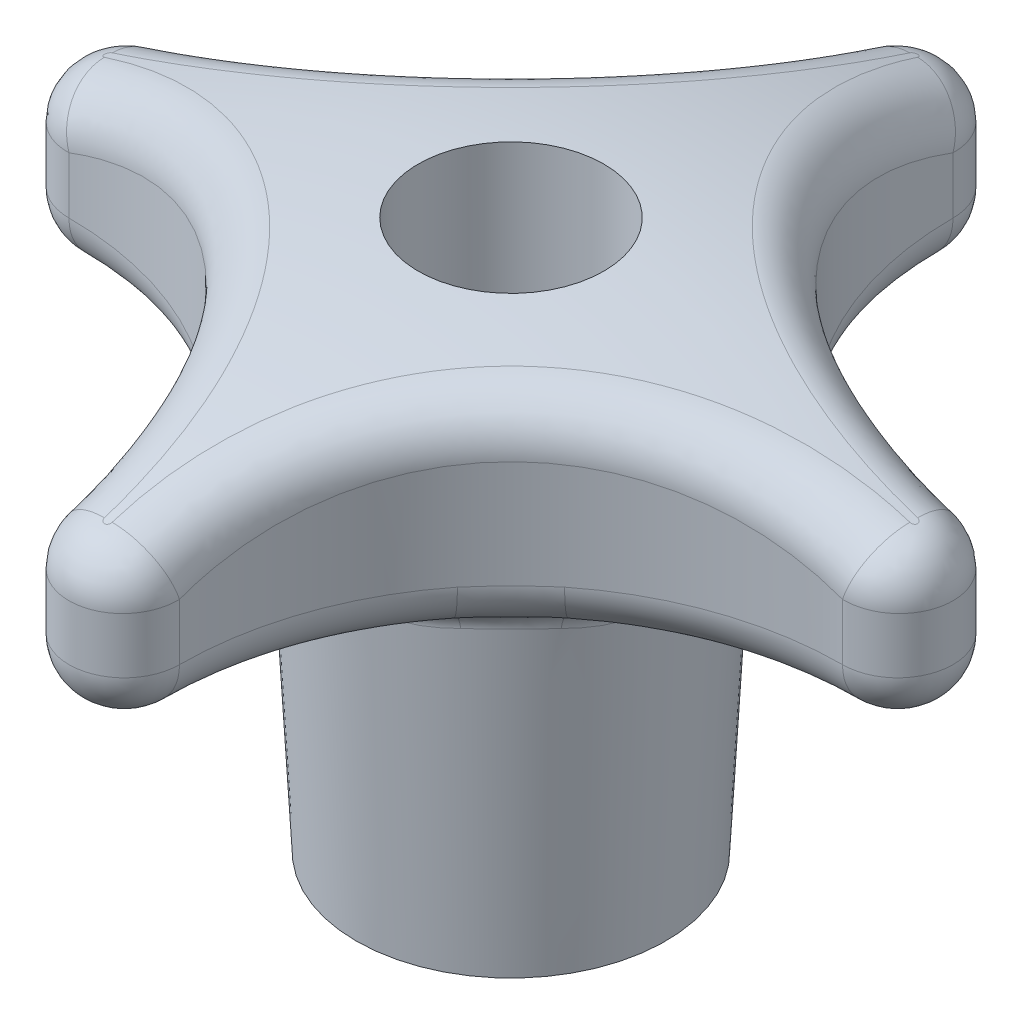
SolidWorks part; units mm, degrees
ref_plane "Front Plane" through (0, 0, 0) normal (0, 0, 1) x (1, 0, 0)
ref_plane "Top Plane" through (0, 0, 0) normal (0, 1, 0) x (1, 0, 0)
ref_plane "Right Plane" through (0, 0, 0) normal (1, 0, 0) x (0, 0, -1)
sketch "Sketch1" plane through (0, 0, 0) normal (0, 1, 0) x (1, 0, 0)
  circle A0 centre (0, 0) radius 7
  dimension "D1" = 14
extrude "Extrude1" add sketch "Sketch1" against normal blind 15
draft "Draft1" type of draft neutral plane draft angle 3 faces to draft 1 parameters "D1"=3
sketch "Sketch2" plane through (0, 0, 0) normal (0, 0, 1) x (1, 0, 0)
  line L0 (0, 0) -> (-20, 0)
  line L1 (-20, 0) -> (-20, 6.5)
  line L2 (0, 0) -> (0, 50000) construction
  line L3 (0, 10) -> (20.2547, 10) construction
  line L4 (0, 0) -> (0, 10)
  arc A0 (0, 10) -> (-20, 6.5) centre (0, -48.8929) ccw
revolve "Revolve1" add sketch "Sketch2" angle 360 about L2
sketch "Sketch4" plane through (0, 0, 0) normal (0, 1, 0) x (1, 0, 0)
  line L0 (0, 0) -> (-50000, 0) construction
  line L1 (0, 0) -> (0, 50000) construction
  line L2 (-17.5, 2.5) -> (-45.9117, 2.5) construction
  line L3 (-2.5, 17.5) -> (-2.5, 40.3224) construction
  arc A0 (0, 20) -> (-2.5, 17.5) centre (0, 17.5) ccw
  arc A1 (-17.5, 2.5) -> (-20, 0) centre (-17.5, 0) ccw
  circle A2 centre (0, 0) radius 20 construction
  arc A3 (-17.5, 2.5) -> (-2.5, 17.5) centre (-17.5, 17.5) ccw
  arc A4 (0, 20) -> (-20, 0) centre (-20, 20) ccw
  point P9 (0, 20)
  point P10 (-20, 0)
  point P13 (-2.5, 17.5)
  point P14 (-17.5, 2.5)
extrude "Extrude3" cut sketch "Sketch4" along normal through all
pattern_circular "CirPattern1" count 4 over 360 about axis through (0, 0, 0) along (0, 1, 0) of "Extrude3"
fillet "Fillet2" radius 2.3333 16 edges at (0, 0, 20) (6.8934, 0, 6.8934) (20, 0, 0) (6.8934, 0, -6.8934) (0, 0, -20) (-6.8934, 0, -6.8934) (-20, 0, 0) (-0.0002, 6.5, 20) (8.4075, 9.1301, 5.57) (20, 6.5, 0.0002) (5.57, 9.1301, -8.4075) (0.0002, 6.5, -20) (-8.4075, 9.1301, -5.57) (-20, 6.5, 0.0002) (-6.8934, 0, 6.8934) (-5.57, 9.1301, 8.4075)
fillet "Fillet3" radius 1.1667 8 edges at (-5.5056, 0, -5.5056) (0, 0, -7.7861) (5.5056, 0, -5.5056) (7.7861, 0, 0) (5.5056, 0, 5.5056) (0, 0, 7.7861) (-5.5056, 0, 5.5056) (-7.7861, 0, 0)
sketch "Sketch6" [suppressed] plane through (0, -30, 0) normal (0, -1, 0) x (1, 0, 0)
  circle A0 centre (0, 0) radius 8
  dimension "D1" = 8
extrude "Extrude5" [suppressed] cut sketch "Sketch6" against normal blind 18
sketch "Sketch7" [suppressed] plane through (0, 0, 0) normal (0, 0, 1) x (1, 0, 0)
  line L0 (0, 2) -> (8, 2)
  line L1 (8, -30) -> (8, 2) construction
  line L2 (8, 2) -> (0, 6.6188)
  line L3 (0, 6.6188) -> (0, 2)
  line L4 (-8, -30) -> (8, -30) construction
revolve "Cut-Revolve1" [suppressed] cut sketch "Sketch7" angle 360 about L3
sketch "Sketch8" plane through (0, -15, 0) normal (0, -1, 0) x (1, 0, 0)
  circle A0 centre (0, 0) radius 4
  dimension "D1" = 8
extrude "Extrude6" cut sketch "Sketch8" against normal blind 13
sketch "Sketch9" plane through (0, -2, 0) normal (0, -1, 0) x (1, 0, 0)
  circle A0 centre (0, 0) radius 4.2
  dimension "D1" = 8.4
extrude "Extrude7" cut sketch "Sketch9" against normal through all
sketch "Sketch10" [suppressed] plane through (0, -24, 0) normal (0, -1, 0) x (1, 0, 0)
  circle A0 centre (0, 0) radius 6
extrude "Extrude8" [suppressed] cut sketch "Sketch10" against normal blind 15
sketch "Sketch11" [suppressed] plane through (0, 0, 0) normal (0, 0, 1) x (1, 0, 0)
  line L0 (5.1, 7.0555) -> (5.1, -2)
  line L1 (0, 0) -> (0, -5.4531) construction
  line L2 (5.1, 7.0555) -> (0, 10)
  line L3 (0, 10) -> (0, -2)
  line L4 (-6, -2) -> (6, -2) construction
  line L5 (5.1, -2) -> (0, -2)
revolve "Cut-Revolve2" [suppressed] cut sketch "Sketch11" angle 360 about L3
equation "\"D2@Sketch2\" = \"D1@Sketch2\"*.65"
equation "\"D1@Sketch4\" = (\"D3@Sketch2\"*2)/8"
equation "\"D2@Sketch4\" =( \"D3@Sketch2\"*2)/8"
equation "\"D1@Sketch7\" = \"D1@Extrude5\""
equation "\"D1@Fillet3\" = \"D1@Fillet2\"/2"
equation "\"D2@Sketch11\" = \"D1@Sketch10\""
